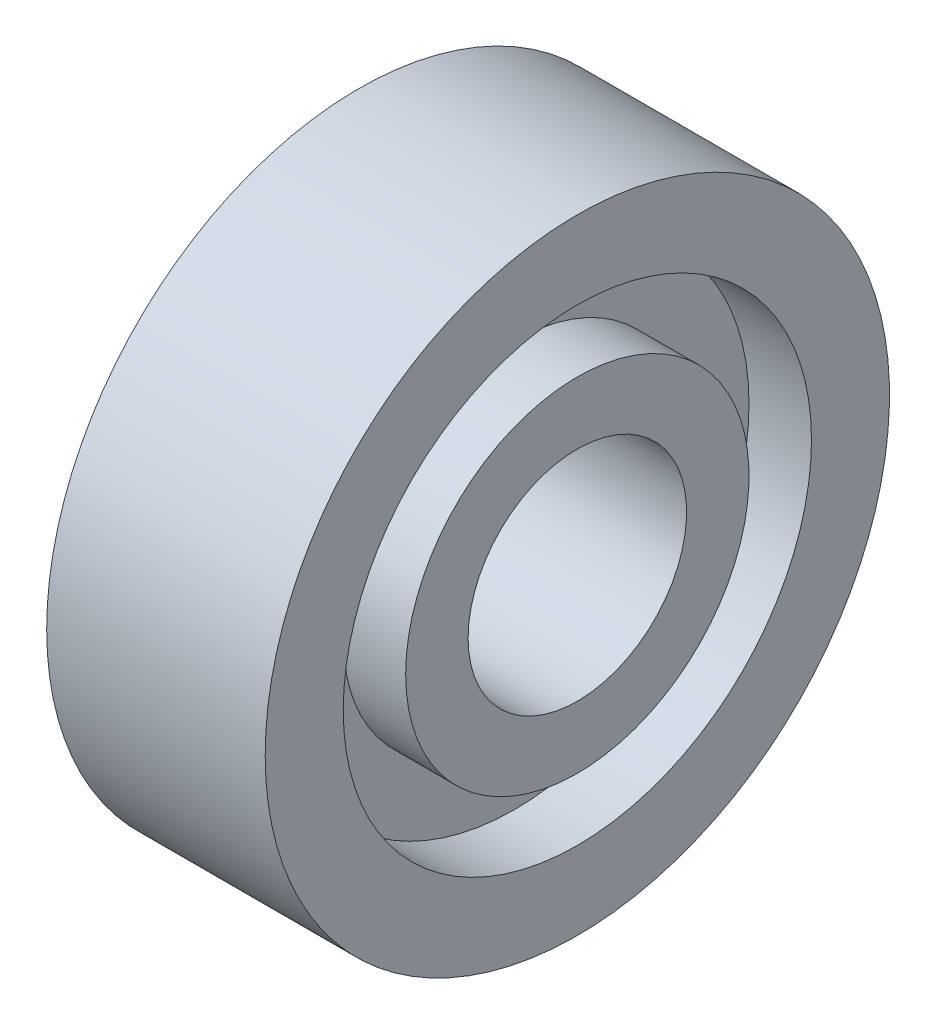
SolidWorks part; units mm, degrees
ref_plane "Plan de face" through (0, 0, 0) normal (0, 0, 1) x (1, 0, 0)
ref_plane "Plan de dessus" through (0, 0, 0) normal (0, 1, 0) x (1, 0, 0)
ref_plane "Plan de droite" through (0, 0, 0) normal (1, 0, 0) x (0, 0, -1)
sketch "Esquisse1" plane through (0, 0, 0) normal (0, 0, 1) x (1, 0, 0)
  line L0 (0, 3.5) -> (0, 10)
  line L1 (0, 0) -> (81.4467, 0) construction
  line L2 (0, 10) -> (7, 10)
  line L3 (7, 10) -> (7, 7.5)
  line L4 (7, 7.5) -> (5, 7.5)
  line L5 (5, 7.5) -> (5, 5.5)
  line L6 (5, 5.5) -> (7, 5.5)
  line L7 (7, 5.5) -> (7, 3.5)
  line L8 (7, 3.5) -> (0, 3.5)
  line L9 (0, 0) -> (0, 26.8576) construction
  dimension "D1" = 3.5
  dimension "D2" = 2.5
  dimension "D3" = 2
  dimension "D4" = 2
  dimension "D5" = 7
  dimension "D6" = 2
revolve "Révolution1" add sketch "Esquisse1" angle 360 about L1
